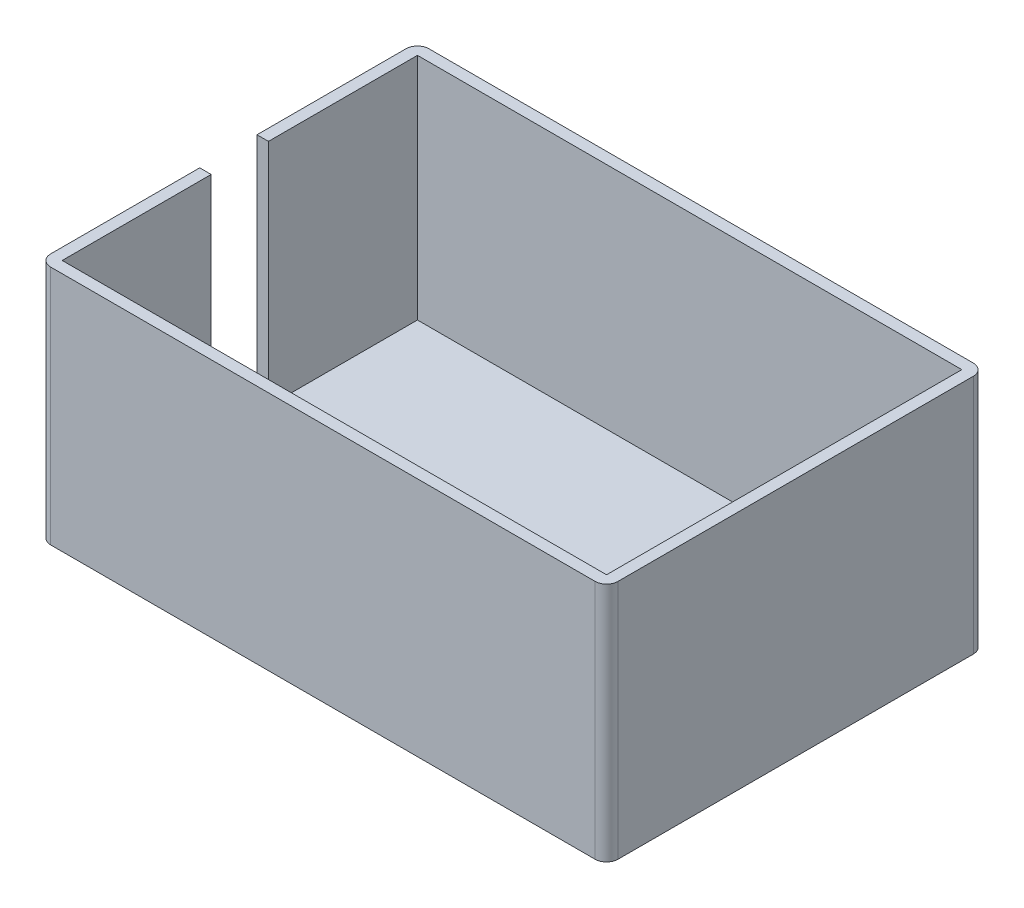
SolidWorks part; units mm, degrees
ref_plane "Front Plane" through (0, 0, 0) normal (0, 0, 1) x (1, 0, 0)
ref_plane "Top Plane" through (0, 0, 0) normal (0, 1, 0) x (1, 0, 0)
ref_plane "Right Plane" through (0, 0, 0) normal (1, 0, 0) x (0, 0, -1)
sketch "Sketch1" plane through (0, 0, 0) normal (0, 0, 1) x (1, 0, 0)
  line L1 (-49.5, 21) -> (49.5, 21)
  line L2 (-49.5, 21) -> (-49.5, -21)
  line L3 (-49.5, -21) -> (49.5, -21)
  line L4 (49.5, 21) -> (49.5, -21)
  point P4 (0, 21)
  point P6 (-49.5, 0)
  dimension "D1" = 99
  dimension "D2" = 42
extrude "Boss-Extrude1" add sketch "Sketch1" against normal blind 66
shell "Shell1" thickness 2
sketch "Sketch2" plane through (-49.5, 0, 0) normal (-1, 0, 0) x (0, 0, 1)
  line L0 (-66, 21) -> (0, 21) construction
  line L1 (-38, 21) -> (-28, 21)
  line L2 (-38, 21) -> (-38, -18.562)
  line L3 (-38, -18.562) -> (-28, -18.562)
  line L4 (-28, 21) -> (-28, -18.562)
  line L5 (-66, -21) -> (0, -21) construction
  point P6 (-33, -21)
  point P9 (-33, -18.562)
  point P10 (-28, -18.562)
  dimension "D1" = 10
extrude "Cut-Extrude1" cut sketch "Sketch2" against normal blind 10 contours L2 L3 L4 L1
fillet "Fillet1" radius 2 4 edges at (-49.5, 0, -66) (49.5, 0, -66) (49.5, 0, 0) (-49.5, 0, 0)
